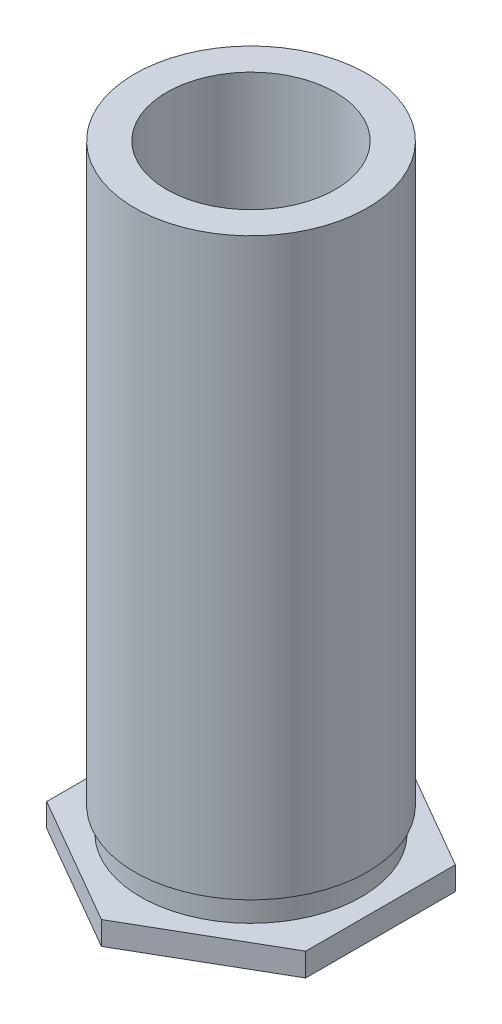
SolidWorks part; units mm, degrees
ref_plane "Plane1" through (0, 0, 0) normal (0, 0, 1) x (1, 0, 0)
ref_plane "Plane2" through (0, 0, 0) normal (0, 1, 0) x (1, 0, 0)
ref_plane "Plane3" through (0, 0, 0) normal (1, 0, 0) x (0, 0, -1)
sketch "BodySke" plane through (0, 0, 0) normal (0, 0, 1) x (1, 0, 0)
  line L0 (3.556, 0) -> (4.5964, 0)
  line L1 (4.5964, 0) -> (4.5964, 0.7112)
  line L2 (4.5964, 0.7112) -> (3.3782, 0.7112)
  line L3 (1.9406, 19.05) -> (1.9406, 0.0051)
  line L4 (3.556, 1.458) -> (3.3782, 1.458)
  line L5 (3.3782, 1.458) -> (3.3782, 0.7112)
  line L6 (3.556, 0.0025) -> (3.556, 0)
  line L7 (1.016, 18.2575) -> (3.6522, 18.2575) construction
  line L8 (3.556, 19.05) -> (1.9406, 19.05)
  line L9 (0, 0) -> (0, 15.24) construction
  line L10 (3.556, 0.0025) -> (0, 0.0025)
  line L11 (3.556, 19.05) -> (3.556, 1.458)
  line L12 (0, 0.0051) -> (1.9406, 0.0051)
  line L13 (0, 0.0051) -> (0, 0.0025)
  line L14 (1.016, 0.0051) -> (3.6522, 0.0051) construction
  line L15 (1.016, 0) -> (3.6522, 0) construction
  dimension "D1" = 0.0025
  dimension "E_dia" = 9.1928
  dimension "C_dia" = 7.112
  dimension "Thread_min" = 3.8811
  dimension "Clinching_ht" = 0.7112
  dimension "Advance" = 0.7925
  dimension "Length" = 19.05
  dimension "Thread_limit" = 19.0449
  dimension "Thread_depth" = 19.0449
  dimension "Drill_depth" = 19.05
  dimension "Groove_wid" = 0.7468
  dimension "Groove_dia" = 6.7564
revolve "Body" add sketch "BodySke"
revolve "EndChamfer" cut sketch "EndChamferSke" angle 360 about L0
sketch "EndChamferSke" plane through (0, 0, 0) normal (0, 0, 1) x (1, 0, 0)
  line L0 (0, -2.54) -> (0, 7.62) construction
  line L1 (0, 0) -> (0, 15.24) construction
  line L2 (2.5781, 11.1252) -> (2.5781, 19.304)
  line L4 (2.5781, 11.1252) -> (2.413, 11.1252)
  line L6 (2.413, 11.1252) -> (1.9406, 10.7945)
  line L8 (1.9406, 10.7945) -> (1.9406, 19.304)
  line L9 (2.5781, 19.304) -> (1.9406, 19.304)
  line L10 (3.556, 19.05) -> (-3.556, 19.05) construction
  dimension "D1" = 0.254
  dimension "Thread_nominal" = 4.826
  dimension "D2" = 34.99
  dimension "Thread_min" = 3.8811
  dimension "Inset" = 7.9248
  dimension "B_dia" = 5.1562
revolve "TapDrill" cut sketch "TapDriSke" angle 360 about L0
sketch "TapDriSke" plane through (0, 0, 0) normal (0, 0, 1) x (1, 0, 0)
  line L0 (0, 0) -> (0, 15.24) construction
  line L1 (0, 0) -> (0, 15.24) construction
  line L2 (1.9406, -3.9573) -> (1.9406, 19.05)
  line L3 (3.556, 19.05) -> (-3.556, 19.05) construction
  line L4 (1.9406, -3.9573) -> (0, -4.7611)
  line L5 (0, -4.7611) -> (0, 19.05)
  line L6 (0, 19.05) -> (1.9406, 19.05)
  line L7 (1.9406, 0.0051) -> (1.9406, 19.05) construction
  line L8 (0, -4.7611) -> (-1.9406, -3.9573) construction
  line L9 (-1.9406, 19.05) -> (-1.9406, 0.0051) construction
  dimension "D1" = 135
  dimension "Depth" = 23.0073
ref_plane "Plane4" through (0, -0.5486, 0) normal (0, 1, 0) x (-1, 0, 0)
sketch "ThdSchSke" plane through (0, 0, 0) normal (0, 0, 1) x (1, 0, 0)
  line L0 (0, -5.08) -> (0, 7.62) construction
  line L1 (0, 0) -> (0, 15.24) construction
  line L2 (0, 11.1252) -> (2.413, 11.1252) construction
  line L4 (2.413, 11.1252) -> (1.9406, 11.456)
  line L5 (2.5781, 11.1252) -> (-2.5781, 11.1252) construction
  line L6 (2.413, 11.1252) -> (1.9406, 10.7944)
  line L7 (1.9406, 11.456) -> (1.9406, 10.7944)
  dimension "Vee_angle" = 70
  dimension "Thread_nominal" = 4.826
  dimension "Thread_min" = 3.8811
revolve "ThreadSchematic" [suppressed] cut sketch "ThdSchSke" angle 360 about L0
pattern_linear "ThdSchPat" [suppressed]
sketch "HexDieSke" plane through (0, 0.7112, 0) normal (0, 1, 0) x (-1, 0, 0)
  line L0 (0, 4.5754) -> (3.9624, 2.2877)
  line L1 (3.9624, 2.2877) -> (3.9624, -2.2877)
  line L2 (3.9624, -2.2877) -> (0, -4.5754)
  line L3 (0, -4.5754) -> (-3.9624, -2.2877)
  line L4 (-3.9624, -2.2877) -> (-3.9624, 2.2877)
  line L5 (-3.9624, 2.2877) -> (0, 4.5754)
  circle A1 centre (0, 0) radius 3.9624 construction
  circle A2 centre (0, 0) radius 4.5754 construction
  circle A3 centre (0, 0) radius 4.6091
  dimension "Width_across_flats" = 7.9248
  dimension "OD" = 9.2182
extrude "HexDie" cut sketch "HexDieSke" against normal blind 0.7112
equation "' \"Length@BodySke\" = 0.75"
equation "' \"B_dia@EndChamferSke\" = 0.203"
equation "' \"C_dia@BodySke\" = 0.28"
equation "' \"Width_across_flats@HexDieSke\" = 0.312"
equation "' \"Inset@EndChamferSke\" = 0.312"
equation "' \"Advance@BodySke\" = 0.0312"
equation "' \"Thread_min@BodySke\" = 0.1528"
equation "' \"Thread_nominal@ThreadCosmetic\" = 0.19"
equation "\"E_dia@BodySke\" = \"Width_across_flats@HexDieSke\" * 1.16"
equation "\"Drill_depth@BodySke\" = \"Length@BodySke\""
equation "\"Thread_depth@BodySke\" = \"Length@BodySke\" - 0.0002"
equation "\"Clinching_ht@BodySke\" = \"C_dia@BodySke\" * 0.1"
equation "\"Groove_dia@BodySke\" = \"C_dia@BodySke\" * 0.95"
equation "\"Groove_wid@BodySke\" = \"Clinching_ht@BodySke\" * 1.05"
equation "\"Thread_limit@BodySke\" = ((sgn( \"Length@BodySke\" - \"Thread_depth@BodySke\" )-1)*( \"Length@BodySke\" - \"Thread_depth@BodySke\" ))/-2+ \"Thread_depth@BodySke\""
equation "\"Depth@TapDriSke\" = \"Thread_limit@BodySke\" + \"Advance@BodySke\" * 5"
equation "\"Depth@TapDriSke\" = ((sgn( \"Depth@TapDriSke\" - \"Drill_depth@BodySke\" )+1)*( \"Depth@TapDriSke\" - \"Drill_depth@BodySke\" ))/2 +\"Drill_depth@BodySke\""
equation "\"Depth@HexDie\" = \"Clinching_ht@BodySke\""
equation "\"OD@HexDieSke\" =  \"Width_across_flats@HexDieSke\" * 1.16 + 0.001"
equation "\"Thread_nominal@EndChamferSke\" = \"Thread_nominal@ThreadCosmetic\""
equation "\"Thread_min@EndChamferSke\" = \"Thread_min@BodySke\""
equation "\"D2@EndChamferSke\" = \"Vee_angle@ThdSchSke\" / 2 - 0.01"
equation "\"Thread_nominal@ThdSchSke\" = \"Thread_nominal@ThreadCosmetic\""
equation "\"Thread_min@ThdSchSke\" = \"Thread_min@BodySke\""
equation "\"Num_threads@ThdSchPat\" = int(  ( \"Thread_limit@BodySke\" - \"Inset@EndChamferSke\" ) / \"Advance@BodySke\" + 0.999 )  + 1"
equation "\"Advance@ThdSchPat\" = (  \"Thread_limit@BodySke\" - \"Inset@EndChamferSke\" ) /  (\"Num_threads@ThdSchPat\" - 1) 'relax it"
